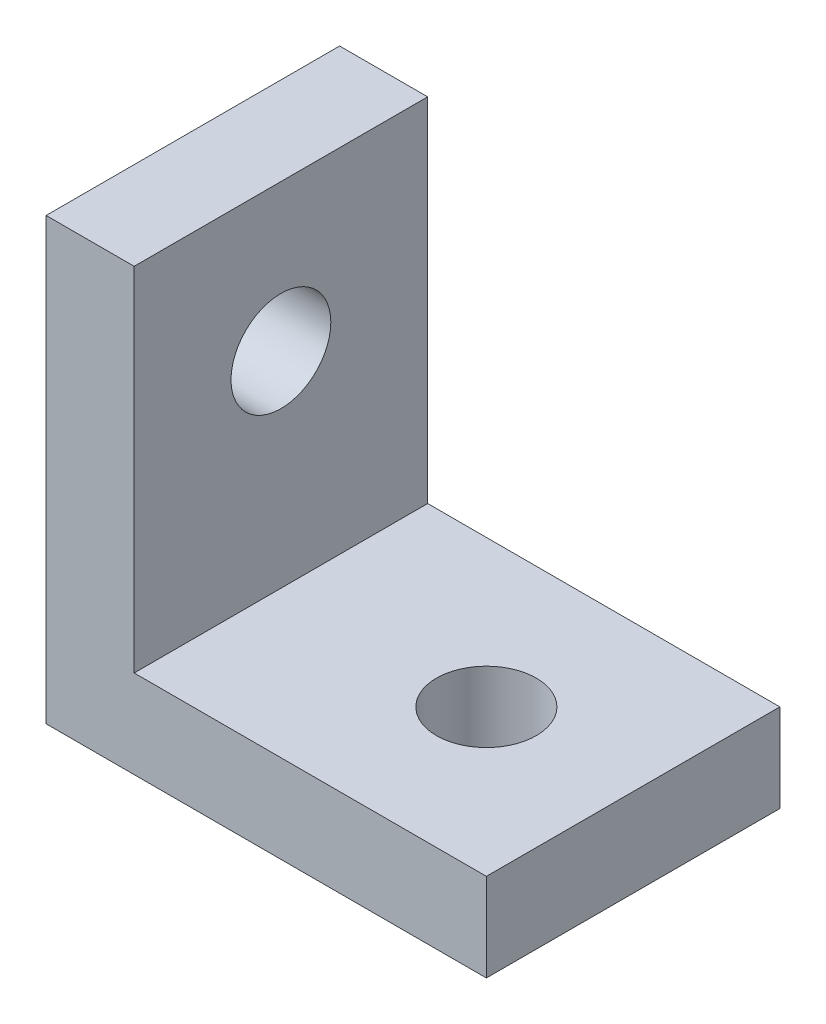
SolidWorks part; units mm, degrees
ref_plane "前视基准面" through (0, 0, 0) normal (0, 0, 1) x (1, 0, 0)
ref_plane "上视基准面" through (0, 0, 0) normal (0, 1, 0) x (1, 0, 0)
ref_plane "右视基准面" through (0, 0, 0) normal (1, 0, 0) x (0, 0, -1)
sketch "草图1" plane through (0, 0, 0) normal (0, 0, 1) x (1, 0, 0)
  line L1 (-7.5, 7.5) -> (7.5, 7.5)
  line L2 (-7.5, 7.5) -> (-7.5, -7.5)
  line L3 (-7.5, -7.5) -> (7.5, -7.5)
  line L4 (7.5, 7.5) -> (7.5, -7.5)
  line L5 (-7.5, 7.5) -> (7.5, -7.5) construction
  line L6 (-7.5, -7.5) -> (7.5, 7.5) construction
  point P0 (0, 0)
  dimension "D1" = 15
  dimension "D2" = 15
extrude "凸台-拉伸1" add sketch "草图1" along normal blind 10
sketch "草图2" plane through (0, 0, 10) normal (0, 0, 1) x (1, 0, 0)
  line L0 (-7.5, 7.5) -> (-7.5, -7.5) construction
  line L1 (19.5, 19.5) -> (-4.5, 19.5)
  line L2 (19.5, 19.5) -> (19.5, -4.5)
  line L3 (19.5, -4.5) -> (-4.5, -4.5)
  line L4 (-4.5, 19.5) -> (-4.5, -4.5)
  line L5 (19.5, 19.5) -> (-4.5, -4.5) construction
  line L6 (19.5, -4.5) -> (-4.5, 19.5) construction
  line L7 (-7.5, -7.5) -> (7.5, -7.5) construction
  point P0 (7.5, 7.5)
  dimension "D1" = 3
  dimension "D2" = 3
extrude "切除-拉伸1" cut sketch "草图2" against normal blind 10
hole_wizard "Ø3.4 (3.4) 直径孔1" positions "草图3" profile "草图4" hole size "Ø3.4" standard "GB"
sketch "草图3" plane through (-4.5, 0, 0) normal (1, 0, 0) x (0, 0, -1)
  line L0 (0, 7.5) -> (0, -4.5) construction
  line L1 (-10, 7.5) -> (0, 7.5) construction
  point P0 (-5, 2.5)
  dimension "D1" = 5
  dimension "D2" = 5
sketch "草图4" plane through (-4.5, 2.5, 5) normal (0, 1, 0) x (0, 0, -1)
  line L0 (0, 0) -> (0, 3)
  line L1 (0, 3) -> (1.7, 3)
  line L2 (1.7, 3) -> (1.7, 0)
  line L5 (1.7, 0) -> (0, 0)
  line L11 (0, -6.35) -> (0, 107.95) construction
  dimension "通孔孔直径" = 3.4
  dimension "通孔孔深度" = 3
hole_wizard "Ø3.4 (3.4) 直径孔2" positions "草图5" profile "草图6" hole size "Ø3.4" standard "GB"
sketch "草图5" plane through (0, -4.5, 0) normal (0, 1, 0) x (1, 0, 0)
  line L0 (-4.5, 0) -> (7.5, 0) construction
  line L1 (7.5, 0) -> (7.5, -10) construction
  point P0 (2.5, -5)
  dimension "D1" = 5
  dimension "D2" = 5
sketch "草图6" plane through (2.5, -4.5, 5) normal (1, 0, 0) x (0, 0, 1)
  line L0 (0, 0) -> (0, 3)
  line L1 (0, 3) -> (1.7, 3)
  line L2 (1.7, 3) -> (1.7, 0)
  line L5 (1.7, 0) -> (0, 0)
  line L11 (0, -6.35) -> (0, 107.95) construction
  dimension "通孔孔直径" = 3.4
  dimension "通孔孔深度" = 3
